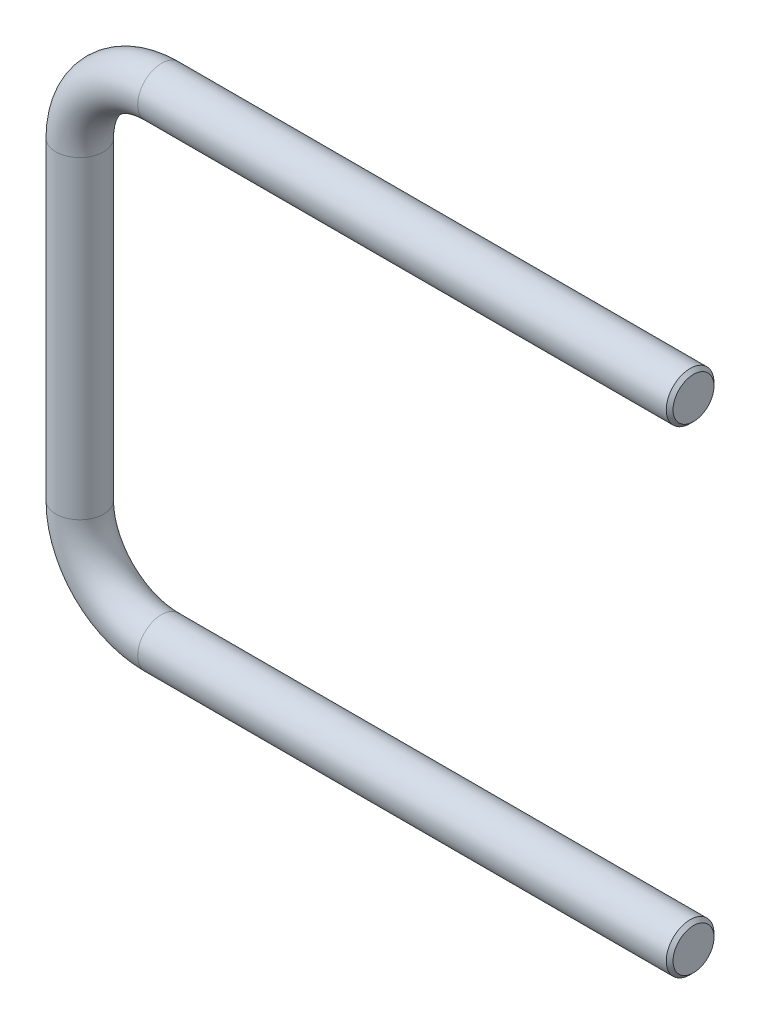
SolidWorks part; units mm, degrees
ref_plane "Plan1" through (0, 0, 0) normal (0, 0, 1) x (1, 0, 0)
ref_plane "Plan2" through (0, 0, 0) normal (0, 1, 0) x (1, 0, 0)
ref_plane "Plan3" through (0, 0, 0) normal (1, 0, 0) x (0, 0, -1)
sketch "Esquisse1" plane through (0, 0, 0) normal (0, 0, 1) x (1, 0, 0)
  line L0 (0, 0) -> (-78, 0)
  line L1 (-90, 12) -> (-90, 58)
  line L2 (-78, 70) -> (0, 70)
  arc A0 (-90, 58) -> (-78, 70) centre (-78, 58) cw
  arc A1 (-78, 0) -> (-90, 12) centre (-78, 12) cw
  point P7 (-90, 70)
  point P10 (-90, 0)
  dimension "D3" = 12
  dimension "D1" = 70
  dimension "D2" = 90
sketch "Esquisse2" plane through (0, 0, 0) normal (1, 0, 0) x (0, 0, -1)
  circle A0 centre (0, 0) radius 3.5
  dimension "D1" = 7
sweep "Base-Balayage" add profiles "Esquisse2" path "Esquisse1"
chamfer "Chanfrein1" distance 0.5 angle 45
